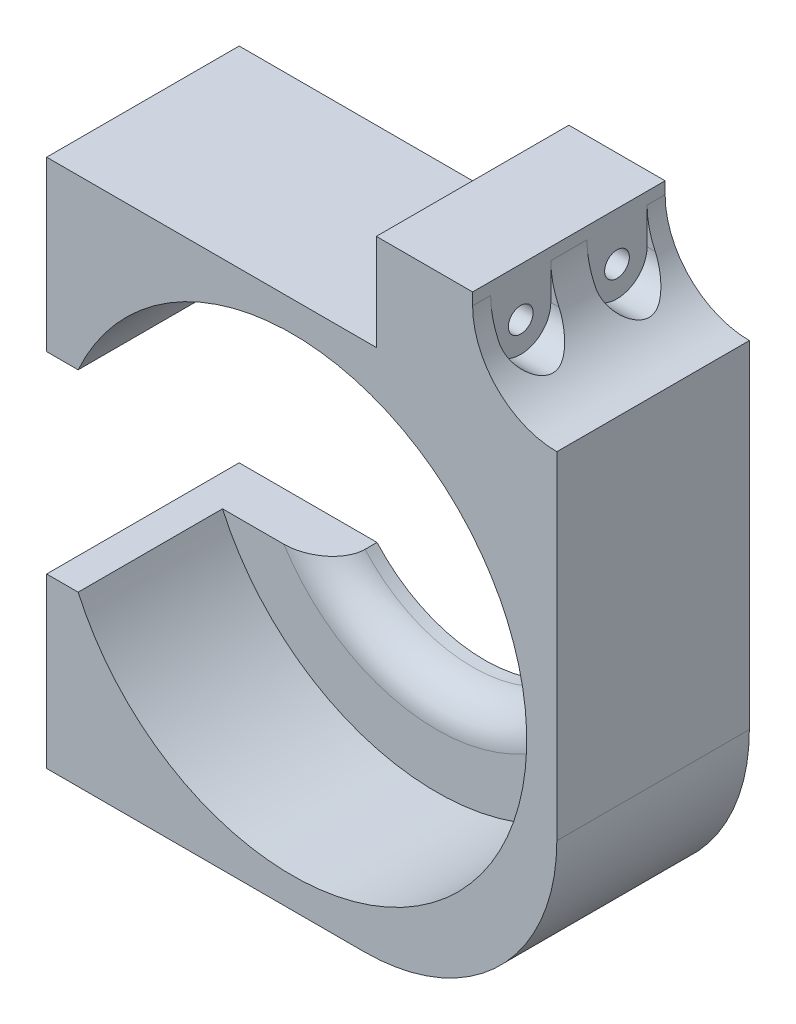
SolidWorks part; units mm, degrees
ref_plane "Front Plane" through (0, 0, 0) normal (0, 0, 1) x (1, 0, 0)
ref_plane "Top Plane" through (0, 0, 0) normal (0, 1, 0) x (1, 0, 0)
ref_plane "Right Plane" through (0, 0, 0) normal (1, 0, 0) x (0, 0, -1)
sketch "Sketch1" plane through (0, 0, 0) normal (0, 0, 1) x (1, 0, 0)
  line L0 (-69.85, 0) -> (0, 0) construction
  line L1 (0, 0) -> (69.85, 0) construction
  line L2 (0, 0) -> (0, -69.85) construction
  line L5 (-88.9, -69.85) -> (88.9, -69.85)
  line L8 (-139.7, -19.05) -> (-139.7, 69.85)
  line L9 (139.7, -19.05) -> (139.7, 69.85)
  line L11 (0, 0) -> (0, 69.85) construction
  line L12 (92.075, 69.85) -> (92.075, 95.25)
  line L13 (92.075, 95.25) -> (117.475, 95.25)
  line L14 (117.475, 95.25) -> (117.475, 92.075)
  line L15 (-117.475, 92.075) -> (-117.475, 95.25)
  line L16 (-117.475, 95.25) -> (-92.075, 95.25)
  line L17 (-92.075, 95.25) -> (-92.075, 69.85)
  line L18 (-92.075, 69.85) -> (92.075, 69.85)
  line L20 (-92.075, 95.25) -> (92.075, 95.25) construction
  line L21 (0, 69.85) -> (0, 95.25) construction
  circle A0 centre (69.85, 0) radius 61.9125
  circle A1 centre (-69.85, 0) radius 61.9125
  arc A2 (139.7, -19.05) -> (88.9, -69.85) centre (88.9, -19.05) cw
  arc A3 (-139.7, -19.05) -> (-88.9, -69.85) centre (-88.9, -19.05) ccw
  arc A4 (-117.475, 92.075) -> (-139.7, 69.85) centre (-139.7, 92.075) cw
  arc A5 (117.475, 92.075) -> (139.7, 69.85) centre (139.7, 92.075) ccw
  point P18 (139.7, -69.85)
  point P21 (-139.7, -69.85)
  point P24 (92.075, 82.55)
  point P32 (111.125, 69.85)
  dimension "D1" = 123.825
  dimension "D2" = 139.7
  dimension "D8" = 50.8
  dimension "D9" = 47.625
  dimension "D10" = 22.225
  dimension "D3" = 25.4
  dimension "D4" = 165.1
  dimension "D5" = 25.4
  dimension "D6" = 69.85
  dimension "D7" = 279.4
extrude "Boss-Extrude1" add sketch "Sketch1" along normal blind 50.8
sketch "Sketch2" plane through (0, 0, 0) normal (0, 0, -1) x (-1, 0, 0)
  circle A0 centre (69.85, 0) radius 61.9125
  circle A1 centre (69.85, 0) radius 38.1
  circle A2 centre (69.85, 0) radius 61.9125 construction
  circle A3 centre (-69.85, 0) radius 38.1
  circle A4 centre (-69.85, 0) radius 61.9125
  dimension "D1" = 76.2
extrude "Boss-Extrude2" add sketch "Sketch2" against normal blind 12.7
hole_wizard "1/4 Clearance Hole1" positions "Sketch3" profile "Sketch4" hole size "1/4" standard "ANSI Inch"
sketch "Sketch3" plane through (139.7, 0, 0) normal (1, 0, 0) x (0, 0, -1)
  line L2 (-38.1, 82.55) -> (-12.7, 82.55) construction
  line L4 (-50.8, 95.25) -> (0, 95.25) construction
  line L5 (-25.4, 95.25) -> (-25.4, 82.55) construction
  point P0 (-12.7, 82.55)
  point P2 (-38.1, 82.55)
  dimension "D1" = 12.7
  dimension "D2" = 25.4
sketch "Sketch4" plane through (139.7, 82.55, 12.7) normal (0, 1, 0) x (0, 0, -1)
  line L0 (0, 0) -> (0, 279.4)
  line L1 (0, 279.4) -> (3.2639, 279.4)
  line L2 (3.2639, 279.4) -> (3.2639, 0)
  line L5 (3.2639, 0) -> (0, 0)
  line L11 (0, -6.35) -> (0, 107.95) construction
  dimension "Thru Hole Dia." = 6.5278
  dimension "Thru Hole Depth" = 279.4
sketch "Sketch6" plane through (0, 0, 50.8) normal (0, 0, 1) x (1, 0, 0)
  line L1 (-117.475, 47.625) -> (-117.475, -47.625)
  line L2 (-117.475, -47.625) -> (-22.225, -47.625)
  line L3 (-22.225, -47.625) -> (-22.225, 47.625)
  line L4 (-22.225, 47.625) -> (-117.475, 47.625)
  line L5 (22.225, 47.625) -> (22.225, -47.625)
  line L6 (22.225, -47.625) -> (117.475, -47.625)
  line L7 (117.475, -47.625) -> (117.475, 47.625)
  line L8 (117.475, 47.625) -> (22.225, 47.625)
  circle A0 centre (-69.85, 0) radius 47.625 construction
  circle A1 centre (69.85, 0) radius 47.625 construction
  dimension "D1" = 95.25
  dimension "D2" = 95.25
extrude "Cut-Extrude2" [suppressed] cut sketch "Sketch6" against normal up to surface (38.1 mm away)
sketch "Sketch9" plane through (0, 0, 0) normal (0, 0, -1) x (-1, 0, 0)
  circle A0 centre (69.85, 0) radius 38.1
  circle A1 centre (-69.85, 0) radius 38.1
  circle A2 centre (69.85, 0) radius 38.1 construction
  circle A3 centre (-69.85, 0) radius 38.1 construction
extrude "Boss-Extrude3" [suppressed] add sketch "Sketch9" against normal up to surface (12.7 mm away)
sketch "Sketch5" plane through (117.475, 0, 0) normal (1, 0, 0) x (0, 0, -1)
  line L0 (-46.0375, 82.55) -> (-46.0375, 95.25)
  line L1 (-46.0375, 95.25) -> (-38.1, 95.25)
  line L2 (-38.1, 95.25) -> (-30.1625, 95.25)
  line L3 (-30.1625, 95.25) -> (-30.1625, 82.55)
  line L4 (-20.6375, 82.55) -> (-20.6375, 95.25)
  line L5 (-20.6375, 95.25) -> (-12.7, 95.25)
  line L6 (-12.7, 95.25) -> (-4.7625, 95.25)
  line L7 (-4.7625, 95.25) -> (-4.7625, 82.55)
  line L8 (-50.8, 95.25) -> (0, 95.25) construction
  arc A0 (-46.0375, 82.55) -> (-30.1625, 82.55) centre (-38.1, 82.55) ccw
  arc A1 (-20.6375, 82.55) -> (-4.7625, 82.55) centre (-12.7, 82.55) ccw
  dimension "D1" = 15.875
extrude "Cut-Extrude1" cut sketch "Sketch5" along normal through all
mirror "Mirror1" about plane through (0, 0, 0) normal (1, 0, 0) of "Cut-Extrude1"
fillet "Fillet2" radius 9.525 2 edges at (-107.95, 0, 12.7) (31.75, 0, 12.7)
sketch "Sketch7" plane through (0, 0, 50.8) normal (0, 0, 1) x (1, 0, 0)
  line L1 (-5.08, -69.85) -> (163.3438, -69.85)
  line L2 (-5.08, -69.85) -> (-5.08, 106.2638)
  line L3 (-5.08, 106.2638) -> (163.3438, 106.2638)
  line L4 (163.3438, -69.85) -> (163.3438, 106.2638)
  line L5 (-88.9, -69.85) -> (88.9, -69.85) construction
  line L6 (-139.7, 69.85) -> (-139.7, -19.05) construction
  dimension "D1" = 134.62
extrude "Cut-Extrude3" [suppressed] cut sketch "Sketch7" against normal through all
sketch "Sketch8" plane through (0, 0, 0) normal (0, 0, -1) x (-1, 0, 0)
  line L1 (-5.08, -69.85) -> (176.2498, -69.85)
  line L2 (-5.08, -69.85) -> (-5.08, 111.4798)
  line L3 (-5.08, 111.4798) -> (176.2498, 111.4798)
  line L4 (176.2498, -69.85) -> (176.2498, 111.4798)
  line L5 (88.9, -69.85) -> (-88.9, -69.85) construction
  line L6 (-139.7, -19.05) -> (-139.7, 69.85) construction
  dimension "D1" = 134.62
extrude "Cut-Extrude4" cut sketch "Sketch8" against normal through all
sketch "Sketch10" plane through (0, 0, 0) normal (0, 0, -1) x (-1, 0, 0)
  line L1 (-48.9547, -25.4) -> (48.9547, -25.4)
  line L3 (-48.9547, 25.4) -> (48.9547, 25.4)
  line L4 (48.9547, -25.4) -> (48.9547, 25.4)
  line L5 (0, 0) -> (48.9547, 0) construction
  line L6 (-48.9547, -25.4) -> (-48.9547, 25.4)
  line L7 (0, 0) -> (0, 25.4) construction
  dimension "D1" = 50.8
extrude "Cut-Extrude5" cut sketch "Sketch10" against normal through all
